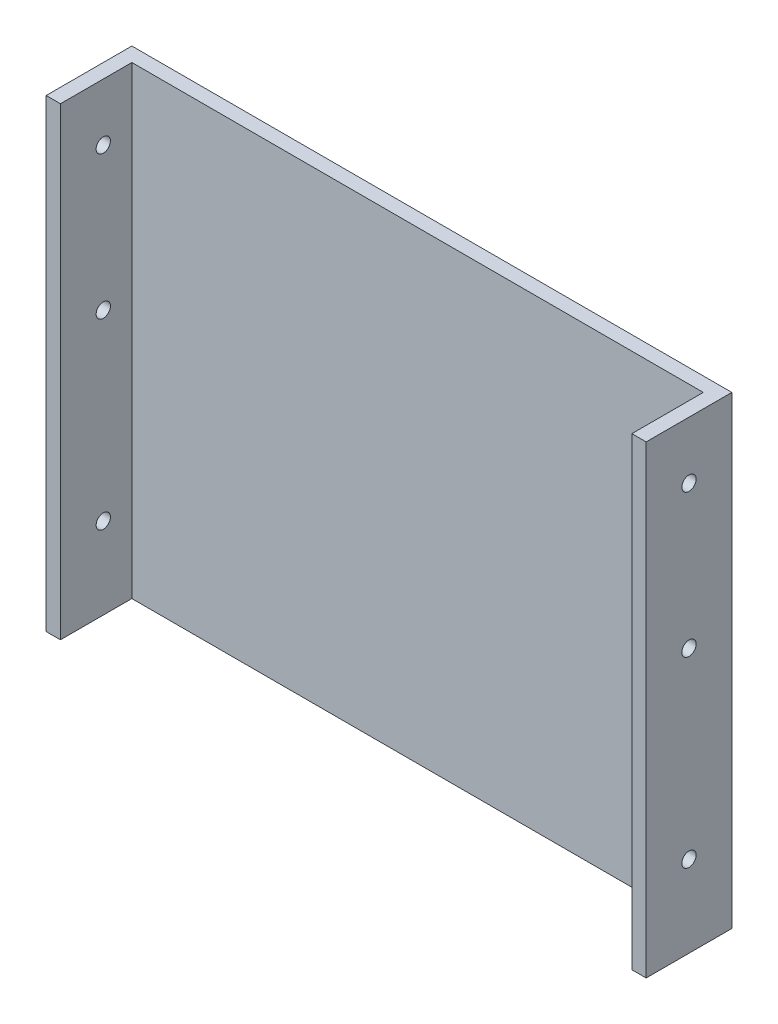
SolidWorks part; units mm, degrees
ref_plane "前视基准面" through (0, 0, 0) normal (0, 0, 1) x (1, 0, 0)
ref_plane "上视基准面" through (0, 0, 0) normal (0, 1, 0) x (1, 0, 0)
ref_plane "右视基准面" through (0, 0, 0) normal (1, 0, 0) x (0, 0, -1)
sketch "草图1" plane through (0, 0, 0) normal (0, 0, 1) x (1, 0, 0)
  line L1 (-42, 32.5) -> (42, 32.5)
  line L2 (-42, 32.5) -> (-42, -32.5)
  line L3 (-42, -32.5) -> (42, -32.5)
  line L4 (42, 32.5) -> (42, -32.5)
  line L5 (-42, 32.5) -> (42, -32.5) construction
  line L6 (-42, -32.5) -> (42, 32.5) construction
  point P0 (0, 0)
  dimension "D1" = 84
  dimension "D2" = 65
extrude "凸台-拉伸1" add sketch "草图1" along normal blind 2
sketch "草图2" plane through (0, 0, 2) normal (0, 0, 1) x (1, 0, 0)
  line L0 (-42, -32.5) -> (42, -32.5) construction
  line L1 (-42, 32.5) -> (-40, 32.5)
  line L2 (-42, 32.5) -> (-42, -32.5)
  line L3 (-42, -32.5) -> (-40, -32.5)
  line L4 (-40, 32.5) -> (-40, -32.5)
  line L5 (0, -1.1) -> (0, 1.1) construction
  line L6 (42, -32.5) -> (40, -32.5)
  line L7 (40, 32.5) -> (40, -32.5)
  line L8 (42, 32.5) -> (40, 32.5)
  line L9 (42, 32.5) -> (42, -32.5)
  dimension "D1" = 2
extrude "凸台-拉伸2" add sketch "草图2" along normal blind 10
sketch "草图3" plane through (-40, 0, 0) normal (1, 0, 0) x (0, 0, -1)
  circle A0 centre (-6, 4.4854) radius 1
  circle A1 centre (-6, -21.0951) radius 1
  circle A2 centre (-6, 24.5) radius 1
extrude "切除-拉伸1" cut sketch "草图3" against normal blind 10
mirror "镜向1" about plane through (0, 0, 0) normal (1, 0, 0) of "切除-拉伸1"
